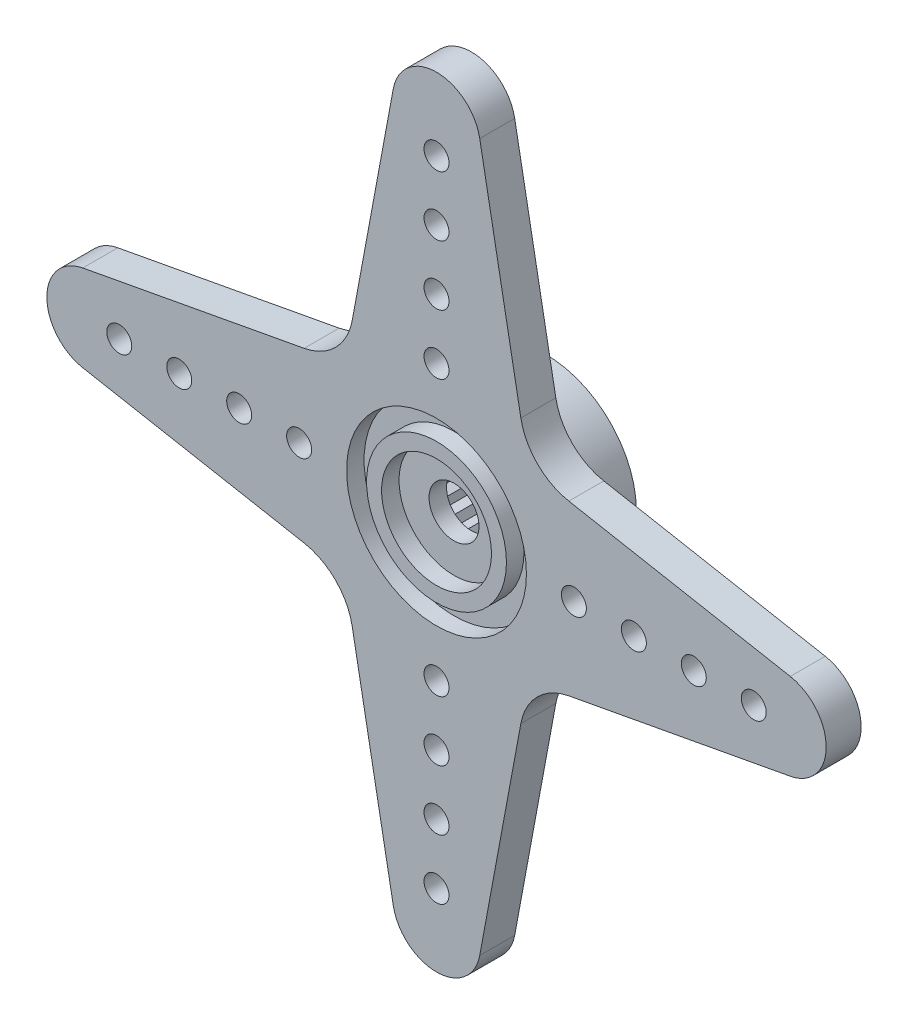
SolidWorks part; units mm, degrees
ref_plane "Front Plane" through (0, 0, 0) normal (0, 0, 1) x (1, 0, 0)
ref_plane "Top Plane" through (0, 0, 0) normal (0, 1, 0) x (1, 0, 0)
ref_plane "Right Plane" through (0, 0, 0) normal (1, 0, 0) x (0, 0, -1)
sketch "Sketch1" plane through (0, 0, 0) normal (0, 0, 1) x (1, 0, 0)
  line L50 (-10.25, 3) -> (-10.5946, 2.7283)
  line L51 (-10.5946, 2.7283) -> (-10.996, 2.9057)
  line L52 (-10.996, 2.9057) -> (-11.2623, 2.5569)
  line L53 (-11.2623, 2.5569) -> (-11.6952, 2.6289)
  line L54 (-11.6952, 2.6289) -> (-11.8664, 2.2248)
  line L55 (-11.8664, 2.2248) -> (-12.3036, 2.1869)
  line L56 (-12.3036, 2.1869) -> (-12.3689, 1.7529)
  line L57 (-12.3689, 1.7529) -> (-12.7829, 1.6075)
  line L58 (-12.7829, 1.6075) -> (-12.7382, 1.1709)
  line L59 (-12.7382, 1.1709) -> (-13.1031, 0.927)
  line L60 (-13.1031, 0.927) -> (-12.9512, 0.5153)
  line L61 (-12.9512, 0.5153) -> (-13.244, 0.1884)
  line L62 (-13.244, 0.1884) -> (-12.9945, -0.1727)
  line L63 (-12.9945, -0.1727) -> (-13.1968, -0.5621)
  line L64 (-13.1968, -0.5621) -> (-12.8654, -0.8498)
  line L65 (-12.8654, -0.8498) -> (-12.9644, -1.2773)
  line L66 (-12.9644, -1.2773) -> (-12.5719, -1.4735)
  line L67 (-12.5719, -1.4735) -> (-12.5615, -1.9123)
  line L68 (-12.5615, -1.9123) -> (-12.1325, -2.0047)
  line L69 (-12.1325, -2.0047) -> (-12.0133, -2.427)
  line L70 (-12.0133, -2.427) -> (-11.5748, -2.4098)
  line L71 (-11.5748, -2.4098) -> (-11.3543, -2.7893)
  line L72 (-11.3543, -2.7893) -> (-10.9339, -2.6636)
  line L73 (-10.9339, -2.6636) -> (-10.626, -2.9763)
  line L74 (-10.626, -2.9763) -> (-10.25, -2.75)
  line L75 (-10.25, -2.75) -> (-9.874, -2.9763)
  line L76 (-9.874, -2.9763) -> (-9.5661, -2.6636)
  line L77 (-9.5661, -2.6636) -> (-9.1456, -2.7893)
  line L78 (-9.1456, -2.7893) -> (-8.9251, -2.4098)
  line L79 (-8.9251, -2.4098) -> (-8.4866, -2.427)
  line L80 (-8.4866, -2.427) -> (-8.3675, -2.0047)
  line L81 (-8.3675, -2.0047) -> (-7.9384, -1.9123)
  line L82 (-7.9384, -1.9123) -> (-7.9281, -1.4735)
  line L83 (-7.9281, -1.4735) -> (-7.5355, -1.2773)
  line L84 (-7.5355, -1.2773) -> (-7.6346, -0.8498)
  line L85 (-7.6346, -0.8498) -> (-7.3031, -0.5621)
  line L86 (-7.3031, -0.5621) -> (-7.5054, -0.1727)
  line L87 (-7.5054, -0.1727) -> (-7.2559, 0.1884)
  line L88 (-7.2559, 0.1884) -> (-7.5487, 0.5153)
  line L89 (-7.5487, 0.5153) -> (-7.3968, 0.927)
  line L90 (-7.3968, 0.927) -> (-7.7617, 1.1709)
  line L91 (-7.7617, 1.1709) -> (-7.717, 1.6075)
  line L92 (-7.717, 1.6075) -> (-8.1311, 1.7529)
  line L93 (-8.1311, 1.7529) -> (-8.1963, 2.1869)
  line L94 (-8.1963, 2.1869) -> (-8.6336, 2.2248)
  line L95 (-8.6336, 2.2248) -> (-8.8047, 2.6289)
  line L96 (-8.8047, 2.6289) -> (-9.2376, 2.5569)
  line L97 (-9.2376, 2.5569) -> (-9.5039, 2.9057)
  line L98 (-9.5039, 2.9057) -> (-9.9053, 2.7283)
  line L99 (-9.9053, 2.7283) -> (-10.25, 3)
  line L100 (-10.25, 3) -> (-10.5946, 2.7283)
  line L101 (-10.5946, 2.7283) -> (-10.996, 2.9057)
  line L102 (-10.996, 2.9057) -> (-11.2623, 2.5569)
  line L103 (-11.2623, 2.5569) -> (-11.6952, 2.6289)
  line L104 (-11.6952, 2.6289) -> (-11.8664, 2.2248)
  line L105 (-11.8664, 2.2248) -> (-12.3036, 2.1869)
  line L106 (-12.3036, 2.1869) -> (-12.3689, 1.7529)
  line L107 (-12.3689, 1.7529) -> (-12.7829, 1.6075)
  line L108 (-12.7829, 1.6075) -> (-12.7382, 1.1709)
  line L109 (-12.7382, 1.1709) -> (-13.1031, 0.927)
  line L110 (-13.1031, 0.927) -> (-12.9512, 0.5153)
  line L111 (-12.9512, 0.5153) -> (-13.244, 0.1884)
  line L112 (-13.244, 0.1884) -> (-12.9945, -0.1727)
  line L113 (-12.9945, -0.1727) -> (-13.1968, -0.5621)
  line L114 (-13.1968, -0.5621) -> (-12.8654, -0.8498)
  line L115 (-12.8654, -0.8498) -> (-12.9644, -1.2773)
  line L116 (-12.9644, -1.2773) -> (-12.5719, -1.4735)
  line L117 (-12.5719, -1.4735) -> (-12.5615, -1.9123)
  line L118 (-12.5615, -1.9123) -> (-12.1325, -2.0047)
  line L119 (-12.1325, -2.0047) -> (-12.0133, -2.427)
  line L120 (-12.0133, -2.427) -> (-11.5748, -2.4098)
  line L121 (-11.5748, -2.4098) -> (-11.3543, -2.7893)
  line L122 (-11.3543, -2.7893) -> (-10.9339, -2.6636)
  line L123 (-10.9339, -2.6636) -> (-10.626, -2.9763)
  line L124 (-10.626, -2.9763) -> (-10.25, -2.75)
  line L125 (-10.25, -2.75) -> (-9.874, -2.9763)
  line L126 (-9.874, -2.9763) -> (-9.5661, -2.6636)
  line L127 (-9.5661, -2.6636) -> (-9.1456, -2.7893)
  line L128 (-9.1456, -2.7893) -> (-8.9251, -2.4098)
  line L129 (-8.9251, -2.4098) -> (-8.4866, -2.427)
  line L130 (-8.4866, -2.427) -> (-8.3675, -2.0047)
  line L131 (-8.3675, -2.0047) -> (-7.9384, -1.9123)
  line L132 (-7.9384, -1.9123) -> (-7.9281, -1.4735)
  line L133 (-7.9281, -1.4735) -> (-7.5355, -1.2773)
  line L134 (-7.5355, -1.2773) -> (-7.6346, -0.8498)
  line L135 (-7.6346, -0.8498) -> (-7.3031, -0.5621)
  line L136 (-7.3031, -0.5621) -> (-7.5054, -0.1727)
  line L137 (-7.5054, -0.1727) -> (-7.2559, 0.1884)
  line L138 (-7.2559, 0.1884) -> (-7.5487, 0.5153)
  line L139 (-7.5487, 0.5153) -> (-7.3968, 0.927)
  line L140 (-7.3968, 0.927) -> (-7.7617, 1.1709)
  line L141 (-7.7617, 1.1709) -> (-7.717, 1.6075)
  line L142 (-7.717, 1.6075) -> (-8.1311, 1.7529)
  line L143 (-8.1311, 1.7529) -> (-8.1963, 2.1869)
  line L144 (-8.1963, 2.1869) -> (-8.6336, 2.2248)
  line L145 (-8.6336, 2.2248) -> (-8.8047, 2.6289)
  line L146 (-8.8047, 2.6289) -> (-9.2376, 2.5569)
  line L147 (-9.2376, 2.5569) -> (-9.5039, 2.9057)
  line L148 (-9.5039, 2.9057) -> (-9.9053, 2.7283)
  line L149 (-9.9053, 2.7283) -> (-10.25, 3)
  circle A0 centre (-10.25, 0) radius 4.5
  dimension "D2" = 9
  dimension "D1" = 0
extrude "Boss-Extrude1" add sketch "Sketch1" against normal blind 3.75 contours A0 L149 L148 L147 L146 L145 L144 L143 L142 L141 L140 L139 L138 L137 L136 L135 L134 L133 L132 L131 L130 L129 L128 L127 L126 L125 L124 L123 L122 L121 L120 L119 L118 L117 L116 L115 L114 L113 L112 L111 L110 L109 L108 L107 L106 L105 L104 L103 L102 L101
sketch "Sketch2" plane through (0, 0, 0) normal (0, 0, 1) x (1, 0, 0)
  circle A0 centre (-10.25, 0) radius 1.25
  circle A1 centre (-10.25, 0) radius 3.5
  circle A2 centre (-10.25, 0) radius 4.5
  dimension "D1" = 7
  dimension "D2" = 2.5
  dimension "D3" = 9
extrude "Boss-Extrude2" add sketch "Sketch2" along normal blind 1.75 contours A2 A1 | A1 A0
sketch "Sketch4" plane through (0, 0, 1.75) normal (0, 0, 1) x (1, 0, 0)
  circle A0 centre (-10.25, 0) radius 3.5
  circle A1 centre (-10.25, 0) radius 2.75
  dimension "D1" = 7
  dimension "D2" = 0.75
extrude "Cut-Extrude1" cut sketch "Sketch4" against normal blind 0.875 contours A1 M2
sketch "Sketch6" plane through (0, 0, 1.75) normal (0, 0, 1) x (1, 0, 0)
  circle A0 centre (-10.25, 0) radius 3.5
  circle A1 centre (-10.25, 0) radius 2.75 construction
  circle A2 centre (-10.25, 0) radius 4.5
  dimension "D1" = 0.75
  dimension "D2" = 9
extrude "Cut-Extrude2" cut sketch "Sketch6" against normal blind 0.875 contours A0 M2
sketch "Sketch7" [suppressed] plane through (0, 0, 1.75) normal (0, 0, 1) x (1, 0, 0)
  circle A0 centre (-10.25, 0) radius 10.5
  circle A1 centre (-10.25, 0) radius 4.5
  dimension "D1" = 21
extrude "Boss-Extrude3" [suppressed] add sketch "Sketch7" against normal blind 1.75
sketch "Sketch9" [suppressed] plane through (0, 0, 1.75) normal (0, 0, 1) x (1, 0, 0)
  line L0 (-10.25, 0) -> (-10.25, 11.6833) construction
  circle A0 centre (-10.25, 7.875) radius 0.625
  circle A1 centre (-14.125, 7.875) radius 0.625
  circle A2 centre (-10.25, 0) radius 10.5 construction
  circle A3 centre (-6.375, 7.875) radius 0.625
  dimension "D1" = 2
  dimension "D2" = 1.25
  dimension "D3" = 1.25
  dimension "D4" = 2.625
extrude "Cut-Extrude3" [suppressed] cut sketch "Sketch9" against normal through all
pattern_circular "CirPattern1" [suppressed] count 4 over 360
chamfer "Chamfer1" [suppressed] distance 1 angle 30
sketch "Sketch10" plane through (0, 0, 1.75) normal (0, 0, 1) x (1, 0, 0)
  line L0 (-10.25, 0) -> (-10.25, 9.0053) construction
  line L1 (-10.25, 0) -> (0.0732, 10.3232) construction
  line L2 (-10.25, 0) -> (1.1009, 0) construction
  line L3 (-8.0869, 17.7016) -> (-6.0299, 6.622)
  line L4 (-3.6279, 4.2201) -> (7.4516, 2.163)
  line L5 (7.4516, -2.163) -> (-3.6279, -4.2201)
  line L6 (-6.0299, -6.622) -> (-8.0869, -17.7016)
  line L7 (-12.413, -17.7016) -> (-14.47, -6.622)
  line L8 (-16.872, -4.2201) -> (-27.9515, -2.163)
  line L9 (-27.9515, 2.163) -> (-16.872, 4.2201)
  line L10 (-14.47, 6.622) -> (-12.413, 17.7016)
  arc A0 (-8.0869, 17.7016) -> (-10.25, 19.5) centre (-10.25, 17.3) ccw
  arc A1 (7.4516, -2.163) -> (7.4516, 2.163) centre (7.05, 0) ccw
  arc A2 (-6.0299, 6.622) -> (-3.6279, 4.2201) centre (-3.0803, 7.1697) ccw
  circle A3 centre (-10.25, 15.875) radius 0.625
  circle A4 centre (-10.25, 12.875) radius 0.625
  circle A5 centre (-10.25, 9.875) radius 0.625
  circle A6 centre (-10.25, 6.875) radius 0.625
  arc A7 (7.4516, -2.163) -> (9.25, 0) centre (7.05, 0) ccw
  circle A8 centre (5.625, 0) radius 0.625
  circle A9 centre (2.625, 0) radius 0.625
  circle A10 centre (-0.375, 0) radius 0.625
  circle A11 centre (-3.375, 0) radius 0.625
  arc A12 (-3.6279, -4.2201) -> (-6.0299, -6.622) centre (-3.0803, -7.1697) ccw
  arc A13 (-12.413, -17.7016) -> (-8.0869, -17.7016) centre (-10.25, -17.3) ccw
  arc A14 (-12.413, -17.7016) -> (-10.25, -19.5) centre (-10.25, -17.3) ccw
  circle A15 centre (-10.25, -15.875) radius 0.625
  circle A16 centre (-10.25, -12.875) radius 0.625
  circle A17 centre (-10.25, -9.875) radius 0.625
  circle A18 centre (-10.25, -6.875) radius 0.625
  arc A19 (-14.47, -6.622) -> (-16.872, -4.2201) centre (-17.4196, -7.1697) ccw
  arc A20 (-27.9515, 2.163) -> (-27.9515, -2.163) centre (-27.5499, 0) ccw
  arc A21 (-27.9515, 2.163) -> (-29.7499, 0) centre (-27.5499, 0) ccw
  circle A22 centre (-26.1249, 0) radius 0.625
  circle A23 centre (-23.1249, 0) radius 0.625
  circle A24 centre (-20.1249, 0) radius 0.625
  circle A25 centre (-17.1249, 0) radius 0.625
  arc A26 (-16.872, 4.2201) -> (-14.47, 6.622) centre (-17.4196, 7.1697) ccw
  arc A27 (-8.0869, 17.7016) -> (-12.413, 17.7016) centre (-10.25, 17.3) ccw
  circle A28 centre (-10.25, 0) radius 4.5
  point P1 (-10.25, 0)
  point P10 (-5.6538, 4.5962)
  point P20 (-5.6538, 4.5962)
  point P21 (-10.25, 19.5)
  point P84 (-10.25, 0)
  dimension "D2" = 19.5
  dimension "D3" = 19.5
  dimension "D4" = 4.4
  dimension "D5" = 4.4
  dimension "D7" = 3
  dimension "D8" = 1.25
  dimension "D9" = 3
  dimension "D1" = 45
  dimension "D6" = 6.5
  dimension "D10" = 4
  dimension "D11" = 4
extrude "Boss-Extrude4" add sketch "Sketch10" against normal blind 1.75 contours A0 A27 L10 A26 L9 A20 L8 A19 L7 A13 L6 A12 L5 A1 L4 A2 L3 A3 A4 A5 A6 A8 A9 A10 A11 A15 A16 A17 A18 A22 A23 M4
chamfer "Chamfer2" distance 1 angle 30 1 edges at (-5.75, 0, 0)
sketch "Sketch11" [suppressed] plane through (0, 0, 1.75) normal (0, 0, 1) x (1, 0, 0)
  line L0 (-10.25, 0) -> (-10.25, 17.5605) construction
  line L1 (-10.25, 0) -> (4.9579, 8.7803) construction
  line L2 (-10.25, 0) -> (4.9579, -8.7803) construction
  line L3 (-10.25, 0) -> (-10.25, -17.5605) construction
  line L4 (-10.25, 0) -> (-25.4578, -8.7803) construction
  line L5 (-10.25, 0) -> (-25.4578, 8.7803) construction
  line L6 (-10.25, 0) -> (-3.969, 10.8789) construction
  line L7 (-10.25, 0) -> (2.312, 0) construction
  line L8 (-10.25, 0) -> (-3.969, -10.8789) construction
  line L9 (-10.25, 0) -> (-16.5309, -10.8789) construction
  line L10 (-10.25, 0) -> (-22.8119, 0) construction
  line L11 (-10.25, 0) -> (-16.5309, 10.8789) construction
  line L12 (-8.5769, 14.5133) -> (-6.25, 6.9282)
  line L13 (-6.25, 6.9282) -> (1.4824, 8.7055)
  line L14 (3.1554, 5.8077) -> (-2.25, 0)
  line L15 (-2.25, 0) -> (3.1554, -5.8077)
  line L16 (1.4824, -8.7055) -> (-6.25, -6.9282)
  line L17 (-6.25, -6.9282) -> (-8.5769, -14.5133)
  line L18 (-11.923, -14.5133) -> (-14.25, -6.9282)
  line L19 (-14.25, -6.9282) -> (-21.9823, -8.7055)
  line L20 (-23.6553, -5.8077) -> (-18.25, 0)
  line L21 (-18.25, 0) -> (-23.6553, 5.8077)
  line L22 (-21.9823, 8.7055) -> (-14.25, 6.9282)
  line L23 (-14.25, 6.9282) -> (-11.923, 14.5133)
  circle A0 centre (-10.25, 0) radius 4.5
  arc A1 (-8.5769, 14.5133) -> (-10.25, 15.75) centre (-10.25, 14) ccw
  arc A2 (3.3899, 7.875) -> (1.4824, 8.7055) centre (1.8744, 7) ccw
  circle A4 centre (-10.25, 13.375) radius 0.625
  circle A5 centre (-10.25, 10.375) radius 0.625
  circle A6 centre (-10.25, 7.375) radius 0.625
  circle A7 centre (1.3331, 6.6875) radius 0.625
  arc A8 (3.1554, 5.8077) -> (3.3899, 7.875) centre (1.8744, 7) ccw
  circle A9 centre (-1.2649, 5.1875) radius 0.625
  circle A10 centre (-3.863, 3.6875) radius 0.625
  arc A11 (3.3899, -7.875) -> (3.1554, -5.8077) centre (1.8744, -7) ccw
  circle A12 centre (1.3331, -6.6875) radius 0.625
  arc A13 (1.4824, -8.7055) -> (3.3899, -7.875) centre (1.8744, -7) ccw
  circle A14 centre (-1.2649, -5.1875) radius 0.625
  circle A15 centre (-3.863, -3.6875) radius 0.625
  arc A16 (-10.25, -15.75) -> (-8.5769, -14.5133) centre (-10.25, -14) ccw
  circle A17 centre (-10.25, -13.375) radius 0.625
  arc A18 (-11.923, -14.5133) -> (-10.25, -15.75) centre (-10.25, -14) ccw
  circle A19 centre (-10.25, -10.375) radius 0.625
  circle A20 centre (-10.25, -7.375) radius 0.625
  arc A21 (-23.8899, -7.875) -> (-21.9823, -8.7055) centre (-22.3743, -7) ccw
  circle A22 centre (-21.833, -6.6875) radius 0.625
  arc A23 (-23.6553, -5.8077) -> (-23.8899, -7.875) centre (-22.3743, -7) ccw
  circle A24 centre (-19.235, -5.1875) radius 0.625
  circle A25 centre (-16.6369, -3.6875) radius 0.625
  arc A26 (-23.8899, 7.875) -> (-23.6553, 5.8077) centre (-22.3743, 7) ccw
  circle A27 centre (-21.833, 6.6875) radius 0.625
  arc A28 (-21.9823, 8.7055) -> (-23.8899, 7.875) centre (-22.3743, 7) ccw
  circle A29 centre (-19.235, 5.1875) radius 0.625
  circle A30 centre (-16.6369, 3.6875) radius 0.625
  arc A31 (-10.25, 15.75) -> (-11.923, 14.5133) centre (-10.25, 14) ccw
  point P5 (-10.25, 0)
  point P12 (-10.25, 0)
  point P20 (-10.25, 0)
  point P22 (-6.25, 6.9282)
  point P26 (-10.25, 15.75)
  point P27 (3.3899, 7.875)
  point P102 (-10.25, 0)
  dimension "D4" = 15.75
  dimension "D5" = 15.75
  dimension "D6" = 3.5
  dimension "D7" = 3.5
  dimension "D9" = 1.25
  dimension "D10" = 1.75
  dimension "D2" = 30
  dimension "D8" = 8
  dimension "D11" = 3
  dimension "D1" = 6
  dimension "D3" = 6
  dimension "D12" = 6
extrude "Boss-Extrude5" [suppressed] add sketch "Sketch11" against normal blind 1.75 contours A1 A31 L23 L22 A28 A26 L21 L20 A23 A21 L19 L18 A18 A16 L17 L16 A13 A11 L15 L14 A8 A2 L13 L12 A0 A4 A5 A6 A7 A9 A10 A12 A14 A15 A17 A19 A20
chamfer "Chamfer4" [suppressed] distance 1 angle 30
sketch "Sketch12" [suppressed] plane through (0, 0, 0.875) normal (0, 0, 1) x (1, 0, 0)
  circle A0 centre (-10.25, 0) radius 1.25
  circle A1 centre (-10.25, 0) radius 5
extrude "Boss-Extrude6" [suppressed] add sketch "Sketch12" along normal blind 0.125
sketch "Sketch14" [suppressed] plane through (0, 0, 1) normal (0, 0, 1) x (1, 0, 0)
  line L0 (-10.25, 0) -> (-28.2499, 0) construction
  line L1 (-10.25, -6) -> (-28.2499, -6)
  line L2 (-10.25, 6) -> (-28.2499, 6)
  arc A0 (-10.25, -6) -> (-10.25, 6) centre (-10.25, 0) ccw
  arc A1 (-28.2499, 6) -> (-28.2499, -6) centre (-28.2499, 0) ccw
  point P4 (-19.2499, 0)
  dimension "D1" = 12
  dimension "D2" = 29.9999
extrude "Boss-Extrude7" [suppressed] add sketch "Sketch14" along normal blind 3
sketch "Sketch16" [suppressed] plane through (0, 0, 1) normal (0, 0, -1) x (-1, 0, 0)
  line L0 (25.9999, 0) -> (30.4999, 0) construction
  line L1 (25.9999, 2.75) -> (30.4999, 2.75)
  line L2 (25.9999, -2.75) -> (30.4999, -2.75)
  arc A0 (25.9999, 2.75) -> (25.9999, -2.75) centre (25.9999, 0) ccw
  arc A1 (30.4999, -2.75) -> (30.4999, 2.75) centre (30.4999, 0) ccw
  arc A10 (28.2499, -6) -> (28.2499, 6) centre (28.2499, 0) ccw construction
  point P3 (28.2499, 0)
  point P8 (34.2499, 0)
  point P9 (33.2499, 0)
  dimension "D2" = 10
  dimension "D3" = 1
  dimension "D1" = 5.5
extrude "Boss-Extrude8" [suppressed] add sketch "Sketch16" along normal blind 2.75 contours L1 A1 L2 A0
sketch "Sketch17" [suppressed] plane through (0, 0, -1.75) normal (0, 0, -1) x (-1, 0, 0)
  circle A0 centre (30.7499, 0) radius 1.5
  circle A1 centre (25.7499, 0) radius 1.5
  arc A5 (28.2499, -6) -> (28.2499, 6) centre (28.2499, 0) ccw construction
  dimension "D1" = 3
  dimension "D2" = 3
  dimension "D3" = 2
  dimension "D4" = 2
extrude "Cut-Extrude4" [suppressed] cut sketch "Sketch17" against normal through all
sketch "Sketch18" [suppressed] plane through (0, 0, 1) normal (0, 0, -1) x (-1, 0, 0)
  circle A0 centre (10.25, 0) radius 3
  dimension "D1" = 6
extrude "Cut-Extrude5" [suppressed] cut sketch "Sketch18" against normal through all
sketch "Sketch19" [suppressed] plane through (0, 0, 1.5) normal (0, 0, 1) x (1, 0, 0)
  line L0 (-35.7499, 0) -> (15.25, 0) construction
  line L1 (-9.625, 5.9674) -> (14.1146, 3.481)
  line L2 (14.1146, -3.481) -> (-9.625, -5.9674)
  line L3 (-10.25, 0) -> (-10.25, 10.691) construction
  line L4 (-34.6145, -3.481) -> (-10.875, -5.9674)
  line L5 (-10.875, 5.9674) -> (-34.6145, 3.481)
  circle A0 centre (-10.25, 0) radius 6
  arc A1 (14.1146, -3.481) -> (14.1146, 3.481) centre (13.75, 0) ccw
  circle A2 centre (14.625, 0) radius 0.625
  circle A3 centre (11.375, 0) radius 0.625
  circle A4 centre (8.125, 0) radius 0.625
  circle A5 centre (4.875, 0) radius 0.625
  circle A6 centre (1.625, 0) radius 0.625
  circle A7 centre (-22.1249, 0) radius 0.625
  circle A8 centre (-25.3749, 0) radius 0.625
  circle A9 centre (-28.6249, 0) radius 0.625
  circle A10 centre (-31.8749, 0) radius 0.625
  circle A11 centre (-35.1249, 0) radius 0.625
  arc A12 (-34.6145, -3.481) -> (-34.6145, 3.481) centre (-34.2499, 0) cw
  point P37 (-10.25, -6)
  dimension "D1" = 12
  dimension "D2" = 7
  dimension "D4" = 1.25
  dimension "D5" = 2
  dimension "D3" = 27.4999
  dimension "D6" = 5
extrude "Boss-Extrude9" [suppressed] add sketch "Sketch19" along normal blind 2.5 contours A12 L4 A0 L5 A10 A8 A7 A9 A11 | A0 M5 | M5 M6 | L2 A1 L1 A0 A6 A5 A4 A3 A2
sketch "Sketch20" [suppressed] plane through (0, 0, 4) normal (0, 0, 1) x (1, 0, 0)
  arc A0 (-9.625, 5.9674) -> (-10.875, 5.9674) centre (-10.25, 0) ccw construction
  circle A1 centre (-10.25, 0) radius 4
  circle A2 centre (-10.25, 0) radius 6
  point P5 (-10.25, 4)
  point P7 (-10.25, -4)
  dimension "D1" = 2
extrude "Boss-Extrude10" [suppressed] add sketch "Sketch20" along normal blind 1
sketch "Sketch21" [suppressed] plane through (0, 0, 4) normal (0, 0, 1) x (1, 0, 0)
  circle A0 centre (-10.25, 0) radius 4 construction
  circle A1 centre (-10.25, 0) radius 4
  circle A2 centre (-10.25, 0) radius 3.25
  dimension "D1" = 0.75
extrude "Boss-Extrude11" [suppressed] add sketch "Sketch21" along normal offset from surface (0.5 mm away) 0.5
sketch "Sketch22" [suppressed] plane through (0, 0, 4) normal (0, 0, 1) x (1, 0, 0)
  circle A0 centre (-10.25, 0) radius 3.25
extrude "Cut-Extrude6" [suppressed] cut sketch "Sketch22" against normal offset from surface (3 mm away) 1 contours A0
chamfer "Chamfer5" [suppressed] distance 0.75 angle 45
ref_plane "Plane1" [suppressed] through (0, 4.5, 0) normal (0, 1, 0) x (1, 0, 0)
ref_plane "Plane3" [suppressed] through (0, 0.5, 0) normal (0, 1, 0) x (1, 0, 0)
sketch "Sketch26" [suppressed] plane through (0, 0.5, 0) normal (0, 1, 0) x (1, 0, 0)
  line L0 (-17.4408, -4) -> (-16.1908, -5)
  line L1 (-10.875, -4) -> (-34.6145, -4) construction
  line L2 (-16.1908, -5) -> (-15.6228, -4)
  line L3 (-15.6228, -4) -> (-17.4408, -4)
  line L4 (-16.25, -5) -> (-4.25, -5) construction
  dimension "D1" = 1.25
extrude "Boss-Extrude15" [suppressed] add sketch "Sketch26" against normal blind 1
ref_plane "Plane4" [suppressed] through (0, 5, 0) normal (0, 1, 0) x (1, 0, 0)
sketch "Sketch27" [suppressed] plane through (0, 5, 0) normal (0, 1, 0) x (1, 0, 0)
  line L0 (-17.4408, -4) -> (-13.2508, -4)
  line L1 (-16.1908, -5) -> (-13.2508, -5)
  line L3 (-17.4408, -4) -> (-16.1908, -5)
  line L4 (-16.1908, -5) -> (-15.6228, -4)
  line L5 (-15.6228, -4) -> (-17.4408, -4)
  line L6 (-17.4408, -4) -> (-16.1908, -5)
  line L10 (-13.2508, -5) -> (-13.2508, -4)
  dimension "D1" = 0
extrude "Boss-Extrude16" [suppressed] add sketch "Sketch27" against normal blind 1 contours L6 L1 L10 L0
mirror "Mirror1" [suppressed] about plane through (0, 0, 0) normal (0, 1, 0)
ref_plane "Plane5" [suppressed] through (-10.25, 0, 0) normal (1, 0, 0) x (0, 0, -1)
mirror "Mirror2" [suppressed] about plane through (-10.25, 0, 0) normal (1, 0, 0)
ref_plane "Plane6" [suppressed] through (0, 0, 2.75) normal (0, 0, 1) x (1, 0, 0)
mirror "Mirror3" [suppressed] about plane through (0, 0, 2.75) normal (0, 0, 1)
mirror "Mirror4" [suppressed] about plane through (-10.25, 0, 0) normal (1, 0, 0)
sketch "Sketch29" [suppressed] plane through (0, -5, 0) normal (0, -1, 0) x (1, 0, 0)
  line L0 (-15.25, 1.5) -> (-5.25, 1.5) construction
  line L1 (-13.2508, 0.5) -> (-7.2491, 0.5)
  line L2 (-13.2508, 0.5) -> (-13.2508, 1.5)
  line L3 (-13.2508, 1.5) -> (-7.2491, 1.5)
  line L4 (-7.2491, 0.5) -> (-7.2491, 1.5)
  line L5 (-7.2491, 0.5) -> (-7.2491, 1.5) construction
extrude "Boss-Extrude17" [suppressed] add sketch "Sketch29" against normal up to surface (1 mm away)
sketch "Sketch31" [suppressed] plane through (0, 0, 5) normal (0, 0, 1) x (1, 0, 0)
  line L1 (-19.5679, -7.6233) -> (-0.9321, -7.6233)
  line L2 (-19.5679, -7.6233) -> (-19.5679, 7.6233)
  line L3 (-19.5679, 7.6233) -> (-0.9321, 7.6233)
  line L4 (-0.9321, -7.6233) -> (-0.9321, 7.6233)
  line L5 (-19.5679, -7.6233) -> (-0.9321, 7.6233) construction
  line L6 (-19.5679, 7.6233) -> (-0.9321, -7.6233) construction
  point P0 (-10.25, 0)
  point P1 (-10.25, 0)
extrude "Cut-Extrude7" [suppressed] cut sketch "Sketch31" against normal blind 0.7493
ref_plane "Plane7" through (-10.25, 0, 0) normal (1, 0, 0) x (0, 0, -1)
